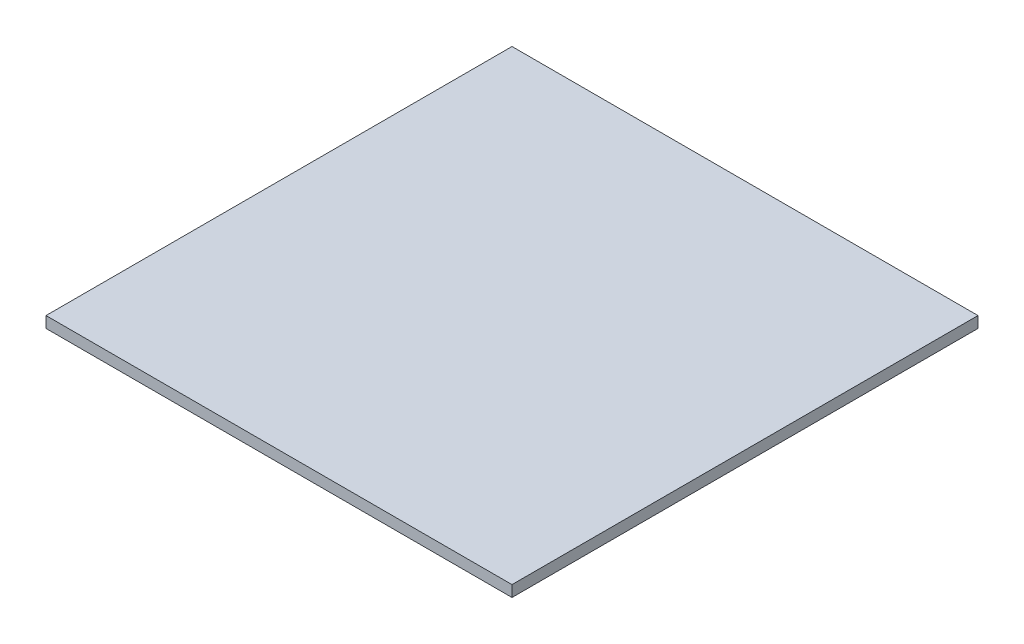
SolidWorks part; units mm, degrees
ref_plane "Plano frontal" through (0, 0, 0) normal (0, 0, 1) x (1, 0, 0)
ref_plane "Plano superior" through (0, 0, 0) normal (0, 1, 0) x (1, 0, 0)
ref_plane "Plano direito" through (0, 0, 0) normal (1, 0, 0) x (0, 0, -1)
sketch "Esboço1" plane through (0, 0, 0) normal (0, 1, 0) x (1, 0, 0)
  line L1 (0, 0) -> (238, 0)
  line L2 (0, 0) -> (0, 250)
  line L3 (0, 250) -> (238, 250)
  line L4 (238, 0) -> (238, 250)
extrude "Ressalto-extrusão1" add sketch "Esboço1" along normal blind 6
sketch "Esboço2" plane through (0, 0, 0) normal (-1, 0, 0) x (0, 0, 1)
  line L1 (0, 6) -> (-250, 6)
  line L2 (0, 6) -> (0, 0)
  line L3 (0, 0) -> (-250, 0)
  line L4 (-250, 6) -> (-250, 0)
extrude "Ressalto-extrusão2" add sketch "Esboço2" along normal blind 12
